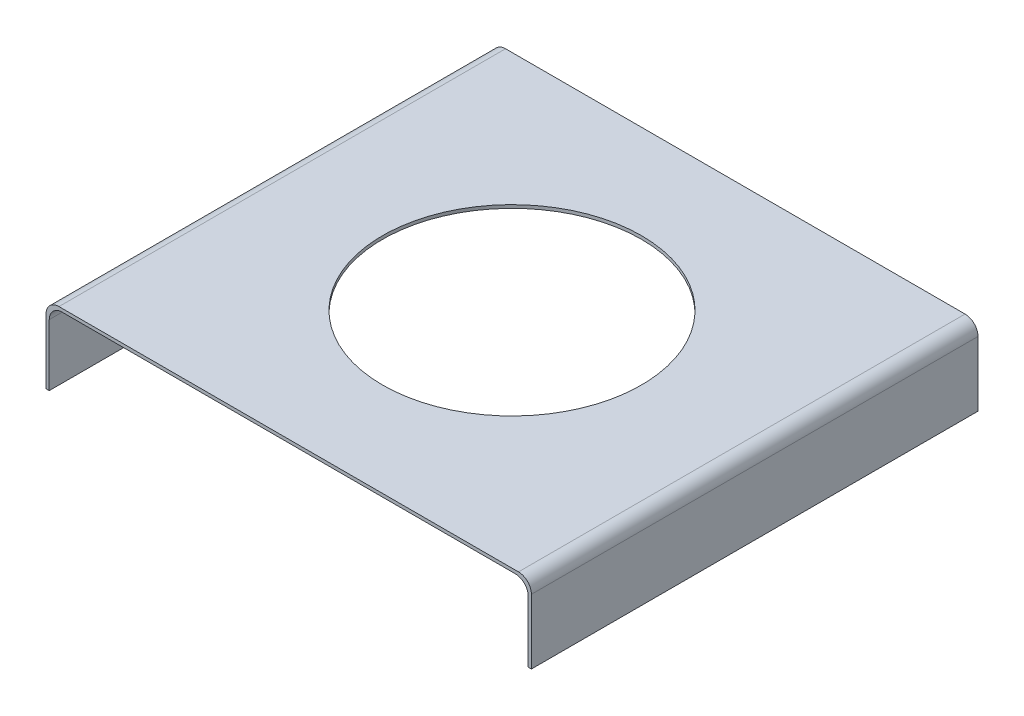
SolidWorks part; units mm, degrees
ref_plane "Front Plane" through (0, 0, 0) normal (0, 0, 1) x (1, 0, 0)
ref_plane "Top Plane" through (0, 0, 0) normal (0, 1, 0) x (1, 0, 0)
ref_plane "Right Plane" through (0, 0, 0) normal (1, 0, 0) x (0, 0, -1)
sketch "Sketch1" plane through (0, 0, 0) normal (0, 0, 1) x (1, 0, 0)
  line L0 (-18.75, 0) -> (18.75, 0)
  line L1 (18.75, 0) -> (18.75, -6)
  line L2 (-18.75, 0) -> (-18.75, -6)
  line L3 (18.5, -0.25) -> (18.5, -6)
  line L4 (-18.5, -0.25) -> (18.5, -0.25)
  line L5 (-18.5, -0.25) -> (-18.5, -6)
  line L6 (-18.75, -6) -> (-18.5, -6)
  line L7 (18.5, -6) -> (18.75, -6)
  dimension "D1" = 37.5
  dimension "D2" = 6
  dimension "D3" = 0.25
extrude "Boss-Extrude1" add sketch "Sketch1" along normal mid plane 34.5
sketch "Sketch2" plane through (0, 0, 0) normal (0, 1, 0) x (1, 0, 0)
  circle A0 centre (0, 0) radius 10
  dimension "D1" = 20
extrude "Cut-Extrude1" cut sketch "Sketch2" against normal through all
fillet "Fillet1" radius 1 4 edges at (-18.5, -0.25, 0) (-18.75, 0, 0) (18.5, -0.25, 0) (18.75, 0, 0)
